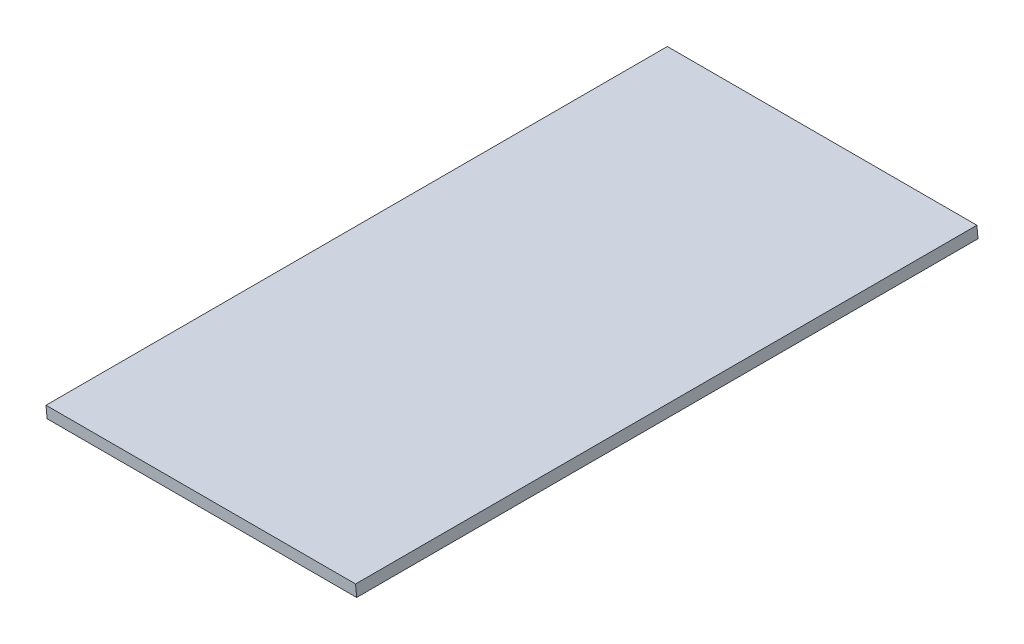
SolidWorks part; units mm, degrees
ref_plane "Plano frontal" through (0, 0, 0) normal (0, 0, 1) x (1, 0, 0)
ref_plane "Plano superior" through (0, 0, 0) normal (0, 1, 0) x (1, 0, 0)
ref_plane "Plano direito" through (0, 0, 0) normal (1, 0, 0) x (0, 0, -1)
sketch "Esboço3" plane through (0, 0, 0) normal (0, 0, 1) x (1, 0, 0)
  line L0 (0, -1000) -> (0, 49000) construction
  line L1 (-250, -1000) -> (-250, 49000) construction
  line L2 (250, -1000) -> (250, 49000) construction
  line L3 (-1000, 0) -> (49000, 0) construction
  line L4 (-1000, -9) -> (49000, -9) construction
  line L5 (-1000, 9) -> (49000, 9) construction
  line L6 (348.4514, -1004.1419) -> (-4574.1167, 48752.9513) construction
  line L7 (-151.5486, -986.1419) -> (-5074.1167, 48770.9513) construction
  line L8 (-250, 9) -> (248.2192, 9)
  line L9 (248.2192, 9) -> (250, -9)
  line L10 (250, -9) -> (-248.2192, -9)
  line L11 (-248.2192, -9) -> (-250, 9)
  dimension "D1" = 250
  dimension "D2" = 250
  dimension "D3" = 9
  dimension "D4" = 9
extrude "Ressalto-extrusão1" add sketch "Esboço3" along normal blind 1000
